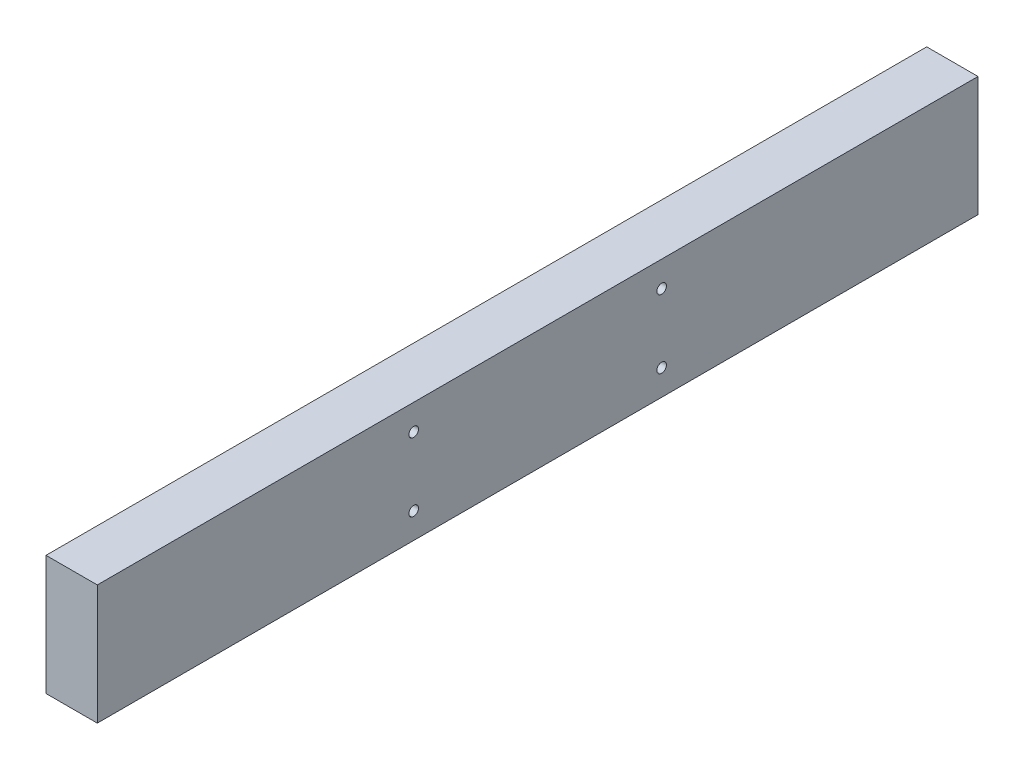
SolidWorks part; units mm, degrees
ref_plane "Front Plane" through (0, 0, 0) normal (0, 0, 1) x (1, 0, 0)
ref_plane "Top Plane" through (0, 0, 0) normal (0, 1, 0) x (1, 0, 0)
ref_plane "Right Plane" through (0, 0, 0) normal (1, 0, 0) x (0, 0, -1)
sketch "Sketch1" plane through (0, 0, 0) normal (0, 0, 1) x (1, 0, 0)
  line L1 (-19.05, -44.45) -> (19.05, -44.45)
  line L2 (-19.05, -44.45) -> (-19.05, 44.45)
  line L3 (-19.05, 44.45) -> (19.05, 44.45)
  line L4 (19.05, -44.45) -> (19.05, 44.45)
  line L5 (-19.05, -44.45) -> (19.05, 44.45) construction
  line L6 (-19.05, 44.45) -> (19.05, -44.45) construction
  point P0 (0, 0)
  dimension "D1" = 88.9
  dimension "D2" = 38.1
extrude "Boss-Extrude1" add sketch "Sketch1" along normal blind 654.05
sketch "Sketch2" plane through (19.05, 0, 0) normal (1, 0, 0) x (0, 0, -1)
  line L0 (-654.05, -44.45) -> (0, -44.45) construction
  line L2 (0, -44.45) -> (0, 44.45) construction
  point P0 (-419.1, 25.4)
  point P1 (-419.1, -25.4)
  point P2 (-234.95, -25.4)
  point P3 (-234.95, 25.4)
  dimension "D1" = 50.8
  dimension "D2" = 19.05
  dimension "D3" = 184.15
  dimension "D4" = 234.95
hole_wizard "9/32 (0.28125) Diameter Hole1" positions "Sketch3" profile "Sketch4" hole size "9/32" standard "ANSI Inch"
sketch "Sketch3" plane through (-19.05, 0, 0) normal (-1, 0, 0) x (0, 0, 1)
  point P0 (234.95, 25.4)
  point P3 (419.1, 25.4)
  point P6 (419.1, -25.4)
  point P9 (234.95, -25.4)
sketch "Sketch4" plane through (-19.05, 25.4, 234.95) normal (0, 1, 0) x (0, 0, 1)
  line L0 (0, 0) -> (0, 38.1)
  line L1 (0, 38.1) -> (3.5719, 38.1)
  line L2 (3.5719, 38.1) -> (3.5719, 0)
  line L5 (3.5719, 0) -> (0, 0)
  line L11 (0, -6.35) -> (0, 107.95) construction
  dimension "Thru Hole Dia." = 7.1437
  dimension "Thru Hole Depth" = 38.1
